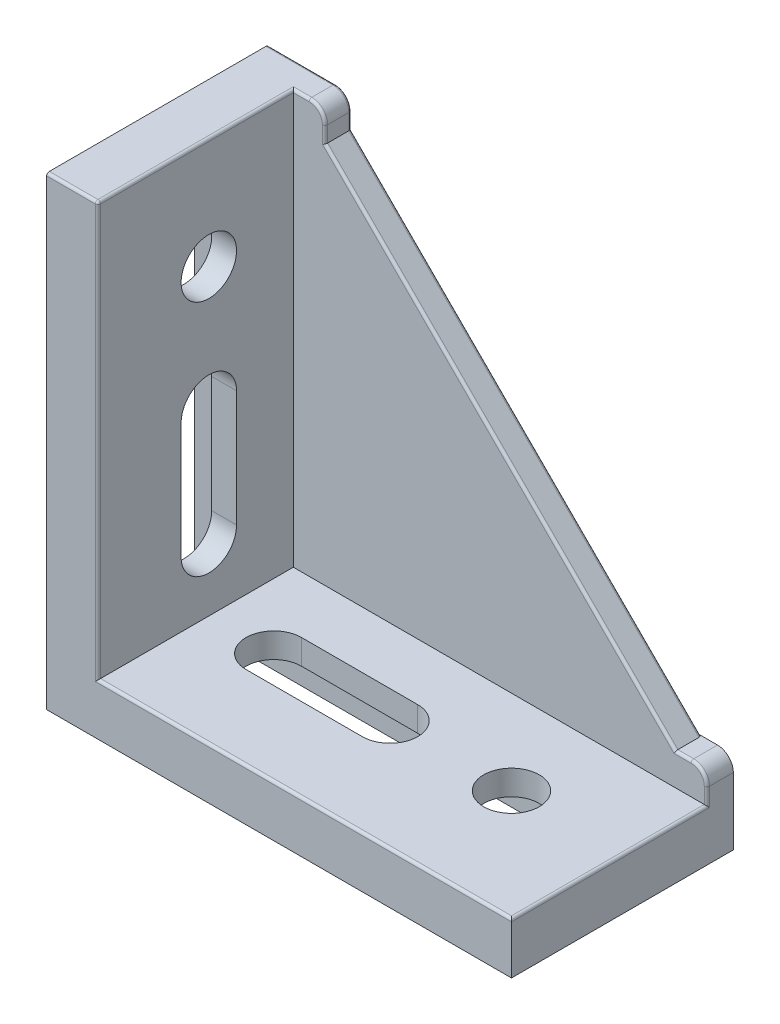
SolidWorks part; units mm, degrees
ref_plane "前视基准面" through (0, 0, 0) normal (0, 0, 1) x (1, 0, 0)
ref_plane "上视基准面" through (0, 0, 0) normal (0, 1, 0) x (1, 0, 0)
ref_plane "右视基准面" through (0, 0, 0) normal (1, 0, 0) x (0, 0, -1)
sketch "草图1" plane through (0, 0, 0) normal (0, 0, 1) x (1, 0, 0)
  line L0 (0, 0) -> (0, 88)
  line L1 (0, 0) -> (88, 0)
  line L2 (88, 0) -> (88, 9.7)
  line L3 (88, 9.7) -> (9.7, 9.7)
  line L4 (9.7, 9.7) -> (9.7, 88)
  line L5 (9.7, 88) -> (0, 88)
  dimension "D1" = 9.7
extrude "凸台-拉伸1" add sketch "草图1" along normal mid plane 42
sketch "草图2" plane through (0, 0, -21) normal (0, 0, -1) x (-1, 0, 0)
  line L0 (-9.7, 88) -> (-15.7, 88)
  line L1 (-15.7, 88) -> (-15.7, 82)
  line L2 (-15.7, 82) -> (-82, 15.7)
  line L3 (-82, 15.7) -> (-88, 15.7)
  line L4 (-88, 15.7) -> (-88, 9.7)
  line L5 (-88, 9.7) -> (-9.7, 9.7)
  line L6 (-9.7, 9.7) -> (-9.7, 88)
  dimension "D1" = 6
  dimension "D2" = 6
  dimension "D3" = 6
  dimension "D4" = 6
extrude "凸台-拉伸2" add sketch "草图2" against normal blind 5
sketch "草图3" plane through (0, 0, 0) normal (-1, 0, 0) x (0, 0, 1)
  line L5 (-7, 80.5) -> (7, 80.5)
  line L6 (-7, 80.5) -> (-7, 7.5)
  line L7 (-7, 7.5) -> (7, 7.5)
  line L8 (7, 80.5) -> (7, 7.5)
  line L11 (17, 84) -> (9.3, 84)
  line L12 (17, 84) -> (17, 71.5)
  line L13 (17, 71.5) -> (9.3, 71.5)
  line L14 (9.3, 84) -> (9.3, 71.5)
  line L17 (17, 67.2) -> (9.3, 67.2)
  line L18 (17, 67.2) -> (17, 37.2)
  line L19 (17, 37.2) -> (9.3, 37.2)
  line L20 (9.3, 67.2) -> (9.3, 37.2)
  line L21 (17, 32.9) -> (9.3, 32.9)
  line L22 (17, 32.9) -> (17, 2.9)
  line L23 (17, 2.9) -> (9.3, 2.9)
  line L24 (9.3, 32.9) -> (9.3, 2.9)
  line L25 (-9.3, 32.9) -> (-9.3, 2.9)
  line L26 (-17, 2.9) -> (-9.3, 2.9)
  line L27 (-17, 32.9) -> (-17, 2.9)
  line L29 (-17, 32.9) -> (-9.3, 32.9)
  line L30 (-9.3, 67.2) -> (-9.3, 37.2)
  line L31 (-17, 37.2) -> (-9.3, 37.2)
  line L32 (-17, 67.2) -> (-17, 37.2)
  line L33 (-17, 67.2) -> (-9.3, 67.2)
  line L34 (-9.3, 84) -> (-9.3, 71.5)
  line L35 (-17, 71.5) -> (-9.3, 71.5)
  line L36 (-17, 84) -> (-17, 71.5)
  line L37 (-17, 84) -> (-9.3, 84)
  point P8 (0, 44)
  dimension "D1" = 14
  dimension "D2" = 73
  dimension "D3" = 4
  dimension "D4" = 4
  dimension "D5" = 7.7
  dimension "D6" = 12.5
  dimension "D7" = 4.3
  dimension "D8" = 30
  dimension "D9" = 4.3
  dimension "D10" = 30
extrude "切除-拉伸1" cut sketch "草图3" against normal blind 5
chamfer "倒角1" distance 5 angle 45 2 edges at (5, 2.9, -13.15) (5, 2.9, 13.15)
sketch "草图4" plane through (5, 0, 0) normal (-1, 0, 0) x (0, 0, 1)
  line L0 (0, 88) -> (0, -7.2996) construction
  line L1 (21, 88) -> (-21, 88) construction
  line L2 (-21, 44) -> (47.8597, 44) construction
  line L3 (-21, 88) -> (-21, 0) construction
  line L4 (0, 44) -> (0, 22) construction
  line L5 (5.25, 44) -> (5.25, 22)
  line L6 (-5.25, 44) -> (-5.25, 22)
  circle A0 centre (0, 67) radius 5.25
  arc A1 (5.25, 44) -> (-5.25, 44) centre (0, 44) ccw
  arc A2 (-5.25, 22) -> (5.25, 22) centre (0, 22) ccw
  point P13 (0, 33)
  dimension "D1" = 21
  dimension "D2" = 10.5
  dimension "D5" = 5.25
  dimension "D3" = 55
  dimension "D4" = 22
extrude "切除-拉伸2" cut sketch "草图4" against normal blind 5
sketch "草图5" plane through (0, 0, 0) normal (-1, 0, 0) x (0, 0, 1)
  line L0 (-21, 44) -> (30.2115, 44) construction
  line L1 (-21, 88) -> (-21, 0) construction
  line L2 (0, 88) -> (0, -3.7102) construction
  line L3 (21, 88) -> (-21, 88) construction
  line L4 (-4, 80.5) -> (4, 80.5)
  line L5 (7, 80.5) -> (-7, 80.5) construction
  line L6 (4, 80.5) -> (4, 82.5)
  line L7 (4, 82.5) -> (-4, 82.5)
  line L8 (-4, 80.5) -> (-4, 82.5)
  line L9 (-4, 7.5) -> (-4, 5.5)
  line L10 (4, 5.5) -> (-4, 5.5)
  line L11 (4, 7.5) -> (4, 5.5)
  line L12 (-4, 7.5) -> (4, 7.5)
  point P16 (0, 82.5)
  point P17 (0, 80.5)
  point P21 (0, 7.5)
  point P22 (0, 5.5)
  dimension "D1" = 4
  dimension "D2" = 2
extrude "凸台-拉伸3" add sketch "草图5" along normal blind 4
chamfer "倒角2" distance 4 angle 20 4 edges at (-4, 81.5, -4) (-4, 81.5, 4) (-4, 6.5, -4) (-4, 6.5, 4)
ref_plane "基准面1" through (0, 0, 0) normal (-0.7071, 0.7071, 0) x (0.7071, 0.7071, 0)
mirror "镜向1" about plane through (0, 0, 0) normal (-0.7071, 0.7071, 0) of "倒角2", "凸台-拉伸3", "切除-拉伸2", "倒角1", "切除-拉伸1"
fillet "圆角1" radius 3 2 edges at (88, 15.7, -18.5) (15.7, 88, -18.5)
fillet "圆角2" radius 0.5 17 edges at (15.7, 83.5, -21) (15.7, 83.5, -16) (14.8213, 87.1213, -21) (77.75, 0, 17) (88, 9.7, 2.5) (6.35, 88, -21) (4.85, 88, 21) (48.85, 9.7, 21) (9.7, 48.85, 21) (9.7, 88, 2.5) (48.85, 48.85, -21) (48.85, 48.85, -16) (11.2, 88, -16) (88, 11.2, -16) (87.1213, 14.8213, -16) (14.8213, 87.1213, -16) (83.5, 15.7, -16)
